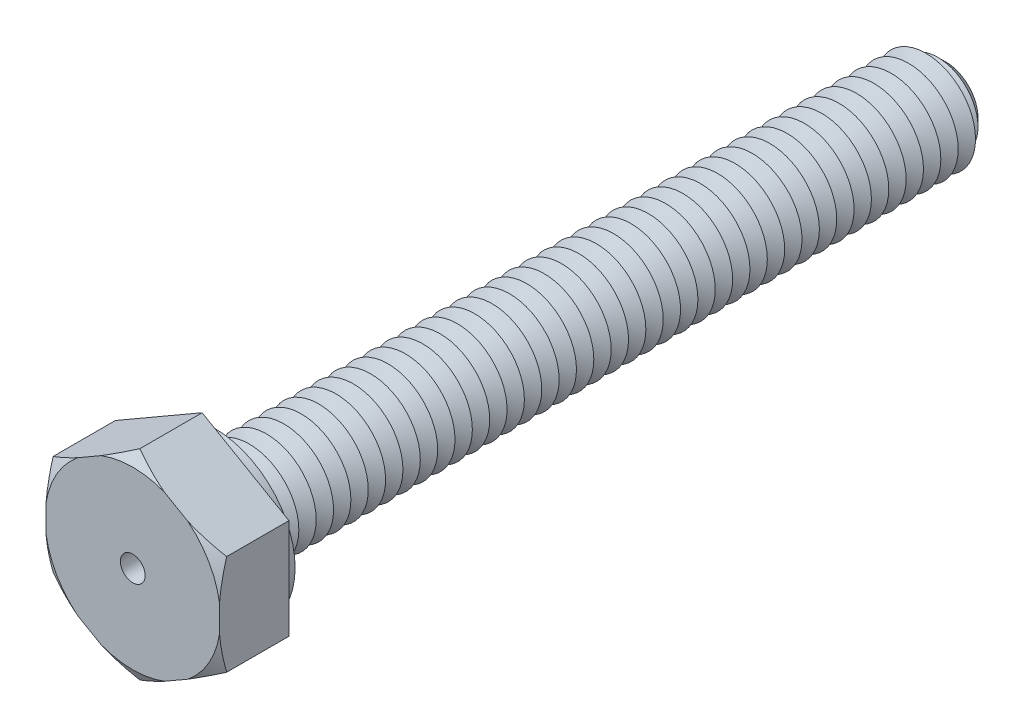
SolidWorks part; units mm, degrees
ref_plane "Front Plane" through (0, 0, 0) normal (0, 0, 1) x (1, 0, 0)
ref_plane "Top Plane" through (0, 0, 0) normal (0, 1, 0) x (1, 0, 0)
ref_plane "Right Plane" through (0, 0, 0) normal (1, 0, 0) x (0, 0, -1)
sketch "Sketch2" plane through (0, 0, 0) normal (0, 0, 1) x (1, 0, 0)
  line L1 (0, 4.0415) -> (-3.5, 2.0207)
  line L2 (-3.5, 2.0207) -> (-3.5, -2.0207)
  line L3 (-3.5, -2.0207) -> (0, -4.0415)
  line L4 (0, -4.0415) -> (3.5, -2.0207)
  line L5 (3.5, -2.0207) -> (3.5, 2.0207)
  line L6 (3.5, 2.0207) -> (0, 4.0415)
  circle A0 centre (0, 0) radius 3.5 construction
  dimension "D1" = 7
extrude "Boss-Extrude1" add sketch "Sketch2" along normal blind 2.8
sketch "Sketch3" plane through (0, 0, 0) normal (0, 0, -1) x (-1, 0, 0)
  circle A0 centre (0, 0) radius 2
  dimension "D1" = 4
extrude "Boss-Extrude2" add sketch "Sketch3" along normal blind 30
sketch "Sketch4" plane through (0, 0, 0) normal (0, 0, -1) x (-1, 0, 0)
  circle A0 centre (0, 0) radius 3.25
  dimension "D1" = 6.5
extrude "Boss-Extrude3" add sketch "Sketch4" along normal blind 0.5
sketch "Sketch5" plane through (0, 0, 0) normal (1, 0, 0) x (0, 0, -1)
  line L0 (-3.2117, 0) -> (6.3192, 0) construction
chamfer "Chamfer1" distance 0.7 angle 45 1 edges at (-2, 0, -30)
sketch "Sketch6" plane through (0, 0, 0) normal (1, 0, 0) x (0, 0, -1)
  line L0 (0.5, 2) -> (0.85, 1.3938)
  line L1 (0.85, 1.3938) -> (1.2, 2)
  line L2 (29.3, 2) -> (0.5, 2) construction
  line L3 (1.2, 2) -> (0.5, 2)
  dimension "D1" = 0.7
revolve "Cut-Revolve1" cut sketch "Sketch6" angle 360 about L0
pattern_linear "LPattern1" count 42 spacing 0.7 along (0, 0, -1) of "Cut-Revolve1"
sketch "Sketch7" plane through (0, 0, 0) normal (1, 0, 0) x (0, 0, -1)
  line L0 (-2.8, 4.0415) -> (-2.8, 3.5415)
  line L1 (-2.8, 2.0207) -> (-2.8, 4.0415) construction
  line L2 (-2.8, 3.5415) -> (-2.5113, 4.0415)
  line L3 (-2.8, 4.0415) -> (0, 4.0415) construction
  line L4 (-2.5113, 4.0415) -> (-2.8, 4.0415)
  dimension "D1" = 0.5
  dimension "D2" = 30
revolve "Cut-Revolve2" cut sketch "Sketch7" angle 360 about L0
sketch "Sketch8" plane through (0, 0, 2.8) normal (0, 0, 1) x (1, 0, 0)
  circle A0 centre (0, 0) radius 0.5
  dimension "D1" = 1
extrude "Cut-Extrude1" cut sketch "Sketch8" against normal up to surface (32.8 mm away)
